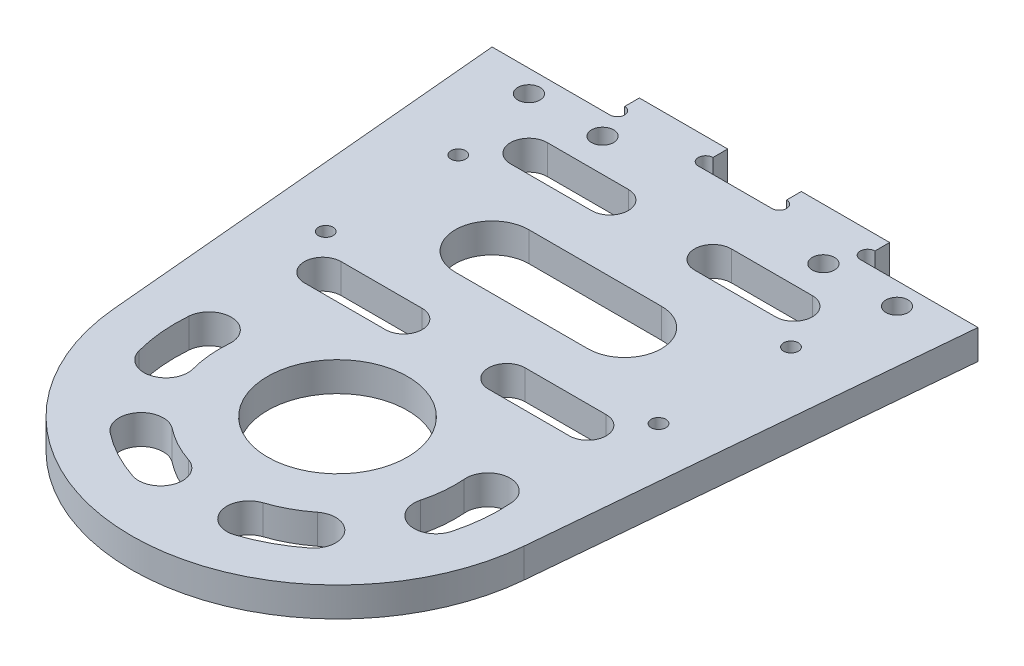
SolidWorks part; units mm, degrees
ref_plane "Front Plane" through (0, 0, 0) normal (0, 0, 1) x (1, 0, 0)
ref_plane "Top Plane" through (0, 0, 0) normal (0, 1, 0) x (1, 0, 0)
ref_plane "Right Plane" through (0, 0, 0) normal (1, 0, 0) x (0, 0, -1)
sketch "Sketch1" plane through (0, 0, 0) normal (0, 1, 0) x (1, 0, 0)
  circle A2 centre (0, 0) radius 28
  circle A3 centre (0, 0) radius 17.5 construction
  circle A4 centre (0, 0) radius 13.5
  circle A5 centre (0, 0) radius 21 construction
  circle A6 centre (0, -17.5) radius 1.5
  circle A7 centre (-17.5, 0) radius 1.5
  circle A8 centre (0, 17.5) radius 1.5
  circle A9 centre (17.5, 0) radius 1.5
  circle A10 centre (0, 0) radius 25 construction
  circle A11 centre (0, -25) radius 1.5
  circle A12 centre (-17.6777, -17.6777) radius 1.5
  circle A13 centre (-25, 0) radius 1.5
  circle A14 centre (-17.6777, 17.6777) radius 1.5
  circle A15 centre (0, 25) radius 1.5
  circle A16 centre (17.6777, 17.6777) radius 1.5
  circle A17 centre (25, 0) radius 1.5
  circle A18 centre (17.6777, -17.6777) radius 1.5
  point P21 (0, 0)
  point P39 (0, 0)
  dimension "D2" = 27
  dimension "D4" = 35
  dimension "D5" = 42
  dimension "D6" = 3
  dimension "D8" = 50
  dimension "D9" = 3
  dimension "D3" = 56
  dimension "D7" = 4
  dimension "D10" = 8
extrude "Boss-Extrude1" add sketch "Sketch1" along normal blind 4
sketch "Sketch5" plane through (0, 0, 0) normal (0, -1, 0) x (1, 0, 0)
  circle A0 centre (0, 0) radius 21
  dimension "D1" = 42
extrude "Cut-Extrude4" cut sketch "Sketch5" against normal blind 10
sketch "Sketch6" plane through (0, 4, 0) normal (0, 1, 0) x (1, 0, 0)
  line L0 (0, 0) -> (0, 54) construction
  line L1 (-33, 54) -> (33, 54)
  line L2 (-33, 54) -> (-27.8861, -2.523)
  line L3 (33, 54) -> (27.8861, -2.523)
  circle A0 centre (0, 0) radius 28 construction
  circle A1 centre (0, 0) radius 28
  point P5 (0, 54)
  dimension "D1" = 54
  dimension "D2" = 66
extrude "Boss-Extrude2" add sketch "Sketch6" against normal through all separate body contours A1 L0 L1 L2 | L0 L3 L1 M9
sketch "Sketch7" plane through (0, 4, 0) normal (0, 1, 0) x (1, 0, 0)
  line L0 (-33, 54) -> (33, 54) construction
  line L1 (-17, 54) -> (-5, 54)
  line L2 (-17, 54) -> (-17, 58)
  line L3 (-17, 58) -> (-5, 58)
  line L4 (-5, 54) -> (-5, 58)
  line L5 (17, 54) -> (5, 54)
  line L6 (17, 54) -> (17, 58)
  line L7 (17, 58) -> (5, 58)
  line L8 (5, 54) -> (5, 58)
  line L9 (-5, 58) -> (5, 58) construction
  point P12 (0, 54)
  point P13 (0, 58)
  dimension "D1" = 12
  dimension "D2" = 4
  dimension "D3" = 10
extrude "Boss-Extrude3" add sketch "Sketch7" against normal through all
sketch "Sketch9" plane through (0, 4, 0) normal (0, 1, 0) x (1, 0, 0)
  line L0 (-33, 54) -> (-17, 54) construction
  circle A0 centre (-25, 51) radius 1.5
  circle A1 centre (-15, 51) radius 1.5
  circle A2 centre (25, 51) radius 1.5
  circle A3 centre (15, 51) radius 1.5
  dimension "D5" = 3
  dimension "D1" = 8
  dimension "D2" = 8
  dimension "D3" = 10
  dimension "D4" = 10
  dimension "D6" = 3
extrude "Cut-Extrude6" cut sketch "Sketch9" against normal through all
sketch "Sketch10" plane through (0, 4, 0) normal (0, 1, 0) x (1, 0, 0)
  circle A0 centre (0, 0) radius 28 construction
  circle A1 centre (0, 0) radius 28
extrude "Boss-Extrude4" add sketch "Sketch10" against normal through all
sketch "Sketch11" plane through (0, 4, 0) normal (0, 1, 0) x (1, 0, 0)
  circle A1 centre (0, 0) radius 9.5
  dimension "D1" = 19
extrude "Cut-Extrude7" cut sketch "Sketch11" against normal through all
sketch "Sketch12" [suppressed] plane through (0, 4, 0) normal (0, 1, 0) x (1, 0, 0)
  circle A0 centre (0, -13.5) radius 1.5 construction
  circle A1 centre (11.6913, 6.75) radius 1.5 construction
  circle A2 centre (-11.6913, 6.75) radius 1.5 construction
  circle A3 centre (0, -13.5) radius 1.5 construction
  circle A4 centre (11.6913, 6.75) radius 1.5 construction
  circle A5 centre (-11.6913, 6.75) radius 1.5 construction
sketch "Sketch8" plane through (0, 4, 0) normal (0, 1, 0) x (1, 0, 0)
  line L0 (5, 58) -> (5, 54) construction
  line L1 (0, -2.2) -> (0, 2.2) construction
  line L2 (-22.6, 39) -> (22.6, 39) construction
  line L3 (-22.6, 39) -> (-22.6, 21) construction
  line L4 (-22.6, 21) -> (22.6, 21) construction
  line L5 (22.6, 39) -> (22.6, 21) construction
  line L6 (-22.6, 39) -> (22.6, 21) construction
  line L7 (-17, 58) -> (-17, 54) construction
  line L8 (-5, 54) -> (-5, 58) construction
  line L9 (17, 54) -> (17, 58) construction
  line L10 (17, 54) -> (33, 54) construction
  line L11 (-5, 54) -> (5, 54) construction
  line L12 (-33, 54) -> (-17, 54) construction
  line L13 (-22.6, 21) -> (22.6, 39) construction
  circle A0 centre (-5, 55) radius 1
  circle A1 centre (5, 55) radius 1
  circle A2 centre (-17, 55) radius 1
  circle A3 centre (17, 55) radius 1
  circle A4 centre (-22.6, 39) radius 1
  circle A5 centre (-22.6, 21) radius 1
  circle A6 centre (22.6, 39) radius 1
  circle A7 centre (22.6, 21) radius 1
  point P2 (0, 30)
  dimension "D1" = 2
  dimension "D2" = 2
  dimension "D3" = 15
  dimension "D4" = 45.2
  dimension "D5" = 18
extrude "Cut-Extrude5" cut sketch "Sketch8" against normal through all
sketch "Sketch13" plane through (0, 4, 0) normal (0, 1, 0) x (1, 0, 0)
  line L0 (-18, 16) -> (-7, 16) construction
  line L1 (-22.6, 39) -> (22.6, 39) construction
  line L2 (-22.6, 39) -> (-22.6, 21) construction
  line L3 (-22.6, 21) -> (22.6, 21) construction
  line L4 (22.6, 39) -> (22.6, 21) construction
  line L5 (-18, 18.5) -> (-7, 18.5)
  line L6 (-18, 13.5) -> (-7, 13.5)
  line L7 (-18, 44) -> (-7, 44) construction
  line L8 (-18, 46.5) -> (-7, 46.5)
  line L9 (-18, 41.5) -> (-7, 41.5)
  line L13 (0, -2.2) -> (0, 2.2) construction
  line L14 (18, 16) -> (7, 16) construction
  line L15 (18, 18.5) -> (7, 18.5)
  line L16 (18, 13.5) -> (7, 13.5)
  line L17 (18, 44) -> (7, 44) construction
  line L18 (18, 46.5) -> (7, 46.5)
  line L19 (18, 41.5) -> (7, 41.5)
  line L20 (-22.6, 39) -> (-22.6, 21) construction
  line L21 (22.6, 39) -> (22.6, 21) construction
  arc A0 (-11.7132, -14.96) -> (-6, -18.0278) centre (0, 0) ccw construction
  arc A1 (-13.5626, -17.3221) -> (-6.9474, -20.8742) centre (0, 0) ccw
  arc A2 (-9.8637, -12.5979) -> (-5.0526, -15.1813) centre (0, 0) ccw
  arc A3 (-9.8637, -12.5979) -> (-13.5626, -17.3221) centre (-11.7132, -14.96) ccw
  arc A4 (-6.9474, -20.8742) -> (-5.0526, -15.1813) centre (-6, -18.0278) ccw
  arc A7 (-18, 18.5) -> (-18, 13.5) centre (-18, 16) ccw
  arc A8 (-7, 13.5) -> (-7, 18.5) centre (-7, 16) ccw
  arc A9 (-18, 46.5) -> (-18, 41.5) centre (-18, 44) ccw
  arc A10 (-7, 41.5) -> (-7, 46.5) centre (-7, 44) ccw
  circle A11 centre (-25, 51) radius 1.5 construction
  arc A12 (18, 18.5) -> (18, 13.5) centre (18, 16) cw
  arc A13 (7, 13.5) -> (7, 18.5) centre (7, 16) cw
  arc A14 (18, 46.5) -> (18, 41.5) centre (18, 44) cw
  arc A15 (7, 41.5) -> (7, 46.5) centre (7, 44) cw
  arc A16 (11.7132, -14.96) -> (6, -18.0278) centre (0, 0) cw construction
  arc A17 (13.5626, -17.3221) -> (6.9474, -20.8742) centre (0, 0) cw
  arc A18 (9.8637, -12.5979) -> (5.0526, -15.1813) centre (0, 0) cw
  arc A19 (9.8637, -12.5979) -> (13.5626, -17.3221) centre (11.7132, -14.96) cw
  arc A20 (6.9474, -20.8742) -> (5.0526, -15.1813) centre (6, -18.0278) cw
  arc A21 (-18.342, -4.957) -> (-18.9407, 1.5) centre (0, 0) cw construction
  arc A22 (-21.9313, 1.7368) -> (-21.2381, -5.7397) centre (0, 0) ccw
  arc A23 (-15.9501, 1.2632) -> (-15.4459, -4.1743) centre (0, 0) ccw
  arc A24 (-15.9501, 1.2632) -> (-21.9313, 1.7368) centre (-18.9407, 1.5) ccw
  arc A25 (-21.2381, -5.7397) -> (-15.4459, -4.1743) centre (-18.342, -4.957) ccw
  arc A26 (18.342, -4.957) -> (18.9407, 1.5) centre (0, 0) ccw construction
  arc A27 (21.9313, 1.7368) -> (21.2381, -5.7397) centre (0, 0) cw
  arc A28 (15.9501, 1.2632) -> (15.4459, -4.1743) centre (0, 0) cw
  arc A29 (15.9501, 1.2632) -> (21.9313, 1.7368) centre (18.9407, 1.5) cw
  arc A30 (21.2381, -5.7397) -> (15.4459, -4.1743) centre (18.342, -4.957) cw
  point P4 (-8.9884, -16.7394)
  point P9 (-18.9188, -1.7542)
  point P21 (-12.5, 16)
  point P26 (-12.5, 44)
  point P41 (12.5, 16)
  point P48 (12.5, 44)
  point P55 (8.9884, -16.7394)
  point P65 (18.9188, -1.7542)
  dimension "D1" = 12
  dimension "D3" = 19
  dimension "D4" = 3
  dimension "D7" = 2.5
  dimension "D2" = 19
  dimension "D5" = 5
  dimension "D6" = 5
  dimension "D8" = 7
  dimension "D9" = 11
  dimension "D11" = 12
  dimension "D12" = 12
extrude "Cut-Extrude9" cut sketch "Sketch13" against normal through all
sketch "Sketch14" plane through (0, 4, 0) normal (0, 1, 0) x (1, 0, 0)
  line L0 (-9, 30) -> (9, 30) construction
  line L1 (-9, 35) -> (9, 35)
  line L2 (-9, 25) -> (9, 25)
  line L3 (0, -2.2) -> (0, 2.2) construction
  line L4 (-5, 54) -> (5, 54) construction
  arc A0 (-9, 35) -> (-9, 25) centre (-9, 30) ccw
  arc A1 (9, 25) -> (9, 35) centre (9, 30) ccw
  point P2 (0, 30)
  dimension "D2" = 5
  dimension "D1" = 24
  dimension "D3" = 18
extrude "Cut-Extrude10" cut sketch "Sketch14" against normal through all
